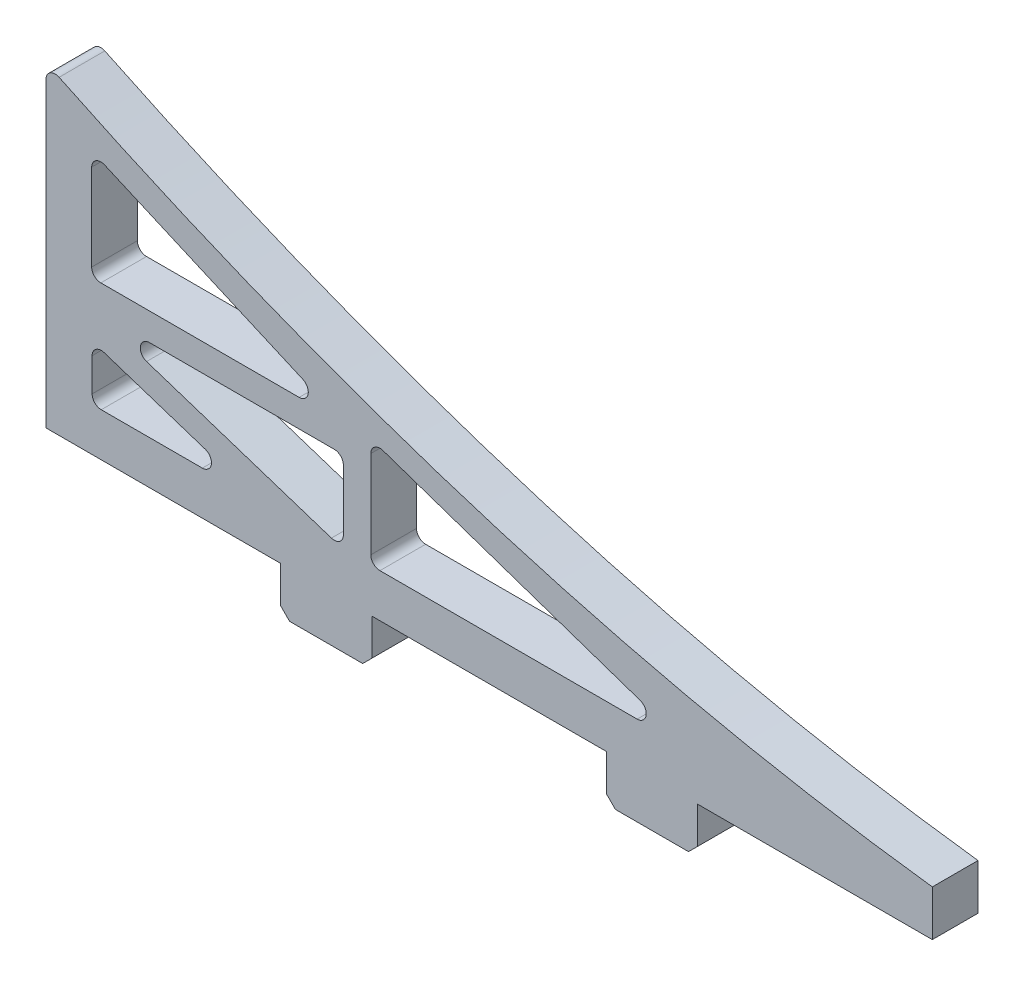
SolidWorks part; units mm, degrees
ref_plane "Plan de face" through (0, 0, 0) normal (0, 0, 1) x (1, 0, 0)
ref_plane "Plan de dessus" through (0, 0, 0) normal (0, 1, 0) x (1, 0, 0)
ref_plane "Plan de droite" through (0, 0, 0) normal (1, 0, 0) x (0, 0, -1)
sketch "Esquisse1" plane through (0, 0, 0) normal (0, 0, 1) x (1, 0, 0)
  line L3 (-16.66, 2.0419) -> (-16.66, -2.9581)
  line L4 (-16.66, -2.9581) -> (-113.66, -2.9581)
  line L5 (-113.66, 31.6875) -> (-113.66, -2.9581)
  spline S0 degree 2 poles (-122.7775, 36.2881) (-64.8687, 6.0777) (-6.96, 1.0179) knots 0 0 0 1 1 1 construction
  spline S1 degree 2 poles (-113.66, 31.6875) (-65.16, 8.0438) (-16.66, 2.0419) knots 0.078723 0.078723 0.078723 0.916248 0.916248 0.916248
  dimension "D1" = 5
  dimension "D2" = 16.66
extrude "Boss.-Extru.1" add sketch "Esquisse1" along normal blind 5
ref_plane "Plan1" through (-113.66, -2.9581, 5) normal (1, 0, 0) x (0, 0, -1)
sketch "Esquisse3" plane through (0, -2.9581, 0) normal (0, -1, 0) x (1, 0, 0)
  line L1 (-88, 5) -> (-78, 5)
  line L2 (-88, 5) -> (-88, 0)
  line L3 (-88, 0) -> (-78, 0)
  line L4 (-78, 5) -> (-78, 0)
  line L6 (-113.66, 5) -> (-16.66, 5) construction
  line L7 (-113.66, 0) -> (-16.66, 0) construction
  line L8 (-113.66, 5) -> (-113.66, 0) construction
  line L10 (-52.34, 5) -> (-42.34, 5)
  line L11 (-52.34, 5) -> (-52.34, 0)
  line L12 (-52.34, 0) -> (-42.34, 0)
  line L13 (-42.34, 5) -> (-42.34, 0)
  dimension "D1" = 5
  dimension "D2" = 10
  dimension "D3" = 25.66
  dimension "D4" = 5
  dimension "D5" = 10
  dimension "D6" = 25.66
extrude "Boss.-Extru.2" add sketch "Esquisse3" along normal blind 5
fillet "Congé1" radius 1 1 edges at (-113.66, 31.6875, 2.5)
sketch "Esquisse4" plane through (0, 0, 5) normal (0, 0, 1) x (1, 0, 0)
  line L0 (-108.66, 25.7911) -> (-108.66, 13.7911)
  line L1 (-108.66, 13.7911) -> (-81.1645, 13.7911)
  line L2 (-81.1645, 13.7911) -> (-108.66, 25.7911)
  line L3 (-113.66, 30.0914) -> (-113.66, -2.9581) construction
  line L4 (-108.6129, 10.7911) -> (-81.1129, 10.7911)
  line L5 (-81.1129, 10.7911) -> (-81.1129, 1.7911)
  line L6 (-81.1129, 1.7911) -> (-108.6129, 10.7911)
  line L7 (-108.6129, 7.7911) -> (-108.6129, 1.7911)
  line L8 (-108.6129, 1.7911) -> (-90.2795, 1.7911)
  line L9 (-90.2795, 1.7911) -> (-108.6129, 7.7911)
  line L10 (-78.1129, 13.7911) -> (-78.1129, 1.7911)
  line L11 (-78.1129, 1.7911) -> (-42.9392, 1.7911)
  line L12 (-42.9392, 1.7911) -> (-78.1129, 13.7911)
  dimension "D1" = 5
  dimension "D2" = 30
  dimension "D3" = 12
  dimension "D4" = 9
  dimension "D5" = 27.5
  dimension "D6" = 3
  dimension "D7" = 360
  dimension "D8" = 3
  dimension "D9" = 3
extrude "Enlèv. mat.-Extru.1" cut sketch "Esquisse4" against normal blind 5
fillet "Congé2" radius 1 1 edges at (-81.1645, 13.7911, 2.5)
fillet "Congé3" radius 1 2 edges at (-108.66, 13.7911, 2.5) (-108.66, 25.7911, 2.5)
fillet "Congé4" radius 1 9 edges at (-42.9392, 1.7911, 2.5) (-78.1129, 1.7911, 2.5) (-78.1129, 13.7911, 2.5) (-81.1129, 10.7911, 2.5) (-81.1129, 1.7911, 2.5) (-108.6129, 10.7911, 2.5) (-108.6129, 7.7911, 2.5) (-108.6129, 1.7911, 2.5) (-90.2795, 1.7911, 2.5)
chamfer "Chanfrein1" distance 1 angle 45 2 edges at (-78, -7.9581, 2.5) (-88, -7.9581, 2.5)
chamfer "Chanfrein2" distance 1 angle 45 2 edges at (-42.34, -7.9581, 2.5) (-52.34, -7.9581, 2.5)
